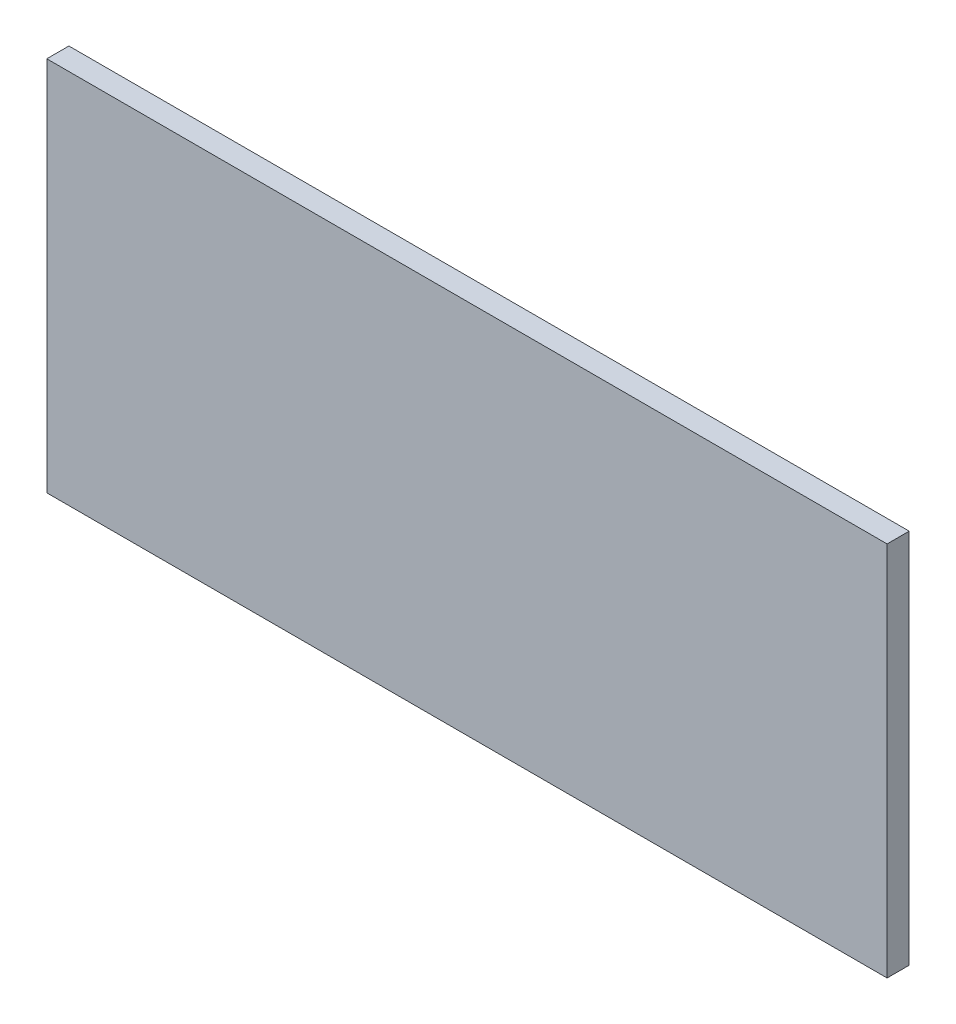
SolidWorks part; units mm, degrees
ref_plane "前视基准面" through (0, 0, 0) normal (0, 0, 1) x (1, 0, 0)
ref_plane "上视基准面" through (0, 0, 0) normal (0, 1, 0) x (1, 0, 0)
ref_plane "右视基准面" through (0, 0, 0) normal (1, 0, 0) x (0, 0, -1)
other "Configuration Table"
sketch "草图1" plane through (0, 0, 0) normal (0, 0, 1) x (1, 0, 0)
  line L1 (95, -42.5) -> (-95, -42.5)
  line L2 (95, -42.5) -> (95, 42.5)
  line L3 (95, 42.5) -> (-95, 42.5)
  line L4 (-95, -42.5) -> (-95, 42.5)
  line L5 (95, -42.5) -> (-95, 42.5) construction
  line L6 (95, 42.5) -> (-95, -42.5) construction
  point P0 (0, 0)
  dimension "D1" = 190
  dimension "D2" = 85
extrude "凸台-拉伸1" add sketch "草图1" along normal blind 5
sketch "草图2" plane through (0, 0, 5) normal (0, 0, 1) x (1, 0, 0)
  line L0 (95, 42.5) -> (-95, 42.5) construction
  line L2 (-95, 42.5) -> (-95, -42.5) construction
  circle A0 centre (-45, 32.5) radius 2.5
  circle A1 centre (30, 32.5) radius 2.5
  circle A2 centre (32, -15.5) radius 3
  circle A3 centre (-50.5, -15.5) radius 3
  circle A4 centre (-45, 32.5) radius 1.5
  circle A5 centre (30, 32.5) radius 1.5
  circle A7 centre (32, -15.5) radius 1.5
  circle A8 centre (-50.5, -15.5) radius 1.5
  dimension "D1" = 5
  dimension "D2" = 5
  dimension "D7" = 6
  dimension "D9" = 3
  dimension "D10" = 3
  dimension "D3" = 75
  dimension "D4" = 48
  dimension "D5" = 10
  dimension "D6" = 2
  dimension "D8" = 82.5
  dimension "D11" = 50
extrude "凸台-拉伸2" add sketch "草图2" against normal blind 10
